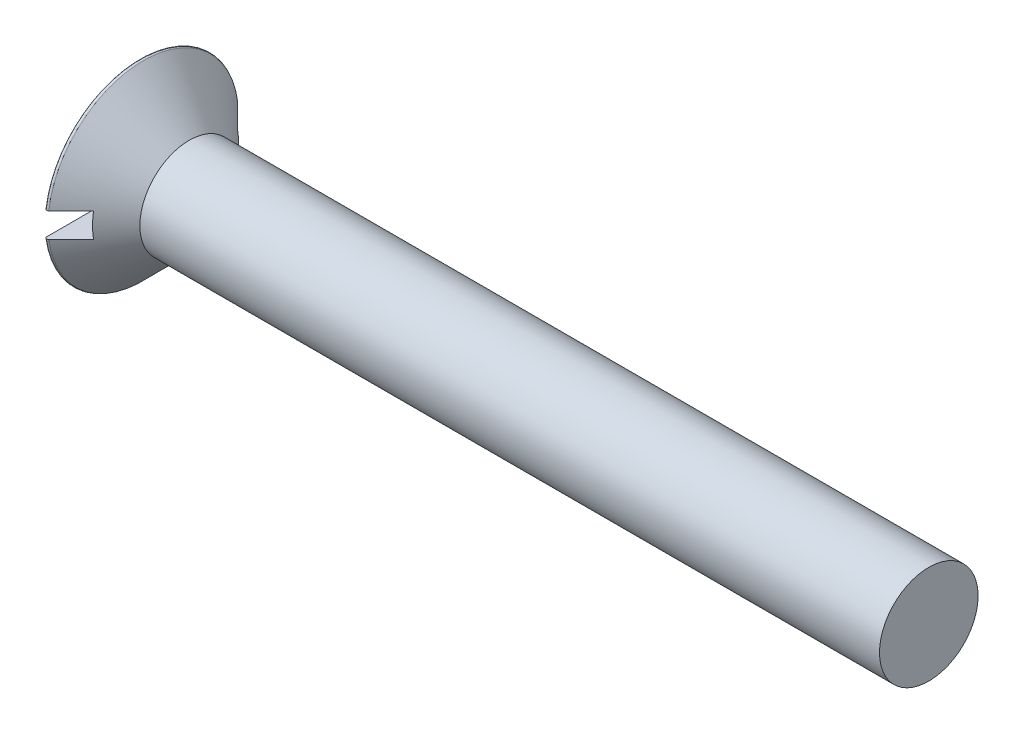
SolidWorks part; units mm, degrees
ref_plane "Front" through (0, 0, 0) normal (0, 0, 1) x (1, 0, 0)
ref_plane "Top" through (0, 0, 0) normal (0, 1, 0) x (1, 0, 0)
ref_plane "Right" through (0, 0, 0) normal (1, 0, 0) x (0, 0, -1)
sketch "Sketch1" plane through (0, 0, 0) normal (0, 0, 1) x (1, 0, 0)
  line L0 (0, 0) -> (0, 10)
  line L1 (0, 10) -> (5, 5)
  line L3 (80, 5) -> (80, 0)
  line L4 (80, 0) -> (0, 0)
  line L5 (-5.5696, 0) -> (0, 0) construction
  line L6 (5, 5) -> (80, 5)
  dimension "l" = 80
  dimension "dk" = 20
revolve "Base" add sketch "Sketch1" angle 360 about L5
fillet "HeadFillet" radius 0.2 1 edges at (0, 0, 10)
sketch "Sketch2" plane through (0, 0, 0) normal (0, 0, 1) x (1, 0, 0)
  line L1 (0, 1.25) -> (2.6, 1.25)
  line L2 (0, 1.25) -> (0, -1.25)
  line L3 (0, -1.25) -> (2.6, -1.25)
  line L4 (2.6, 1.25) -> (2.6, -1.25)
  dimension "t" = 2.6
  dimension "n" = 2.5
  dimension "m" = 1.25
extrude "Notch" cut sketch "Sketch2" against normal through all and the other way through all
sketch "Sketch3" plane through (0, 0, 0) normal (0, 0, 1) x (1, 0, 0)
  line L0 (4.4877, 0) -> (-0.464, 0) construction
  line L1 (5, 9.19) -> (41.5, 9.19)
  line L2 (5, 9.19) -> (5, 4.19)
  line L3 (5, 4.19) -> (37.7, 4.19)
  line L4 (41.5, 9.19) -> (41.5, 5)
  line L6 (41.5, 5) -> (37.7, 4.19)
  line L7 (80, -5) -> (80, 5) construction
  line L10 (0, 9.5172) -> (0, 1.25) construction
  dimension "b" = 38.5
  dimension "x" = 3.8
  dimension "D4" = 5
sketch "Sketch4" plane through (0, 0, 0) normal (0, 0, 1) x (1, 0, 0)
  line L0 (80, 4.2968) -> (80.406, 5)
  line L1 (80.406, 5) -> (80.406, 5.812)
  line L2 (80.406, 5.812) -> (79.594, 5.812)
  line L3 (79.594, 5.812) -> (79.594, 5)
  line L4 (79.594, 5) -> (80, 4.2968)
  line L5 (80, -5) -> (80, 5) construction
  line L6 (0, 0) -> (84.1591, 0) construction
  dimension "D1" = 10
  dimension "D2" = 0.812
revolve "Cut-Revolve10" [suppressed] cut sketch "Sketch4" angle 360 about L6
pattern_linear "LPattern10" [suppressed] count 74 spacing 0.9744 along (1, 0, 0)
equation "\"m@Sketch2\" = \"n@Sketch2\" / 2"
equation "\"D1@Sketch4\" = \"d@Sketch1\""
equation "\"D2@Sketch4\" =  ( \"d@Sketch1\" - \"D2@ThreadCosmetic1\" )  / 2"
equation "\"D3@LPattern10\" = \"D2@Sketch4\" * 1.2"
equation "\"D1@LPattern10\" = \"D1@ThreadCosmetic1\" / \"D3@LPattern10\""
